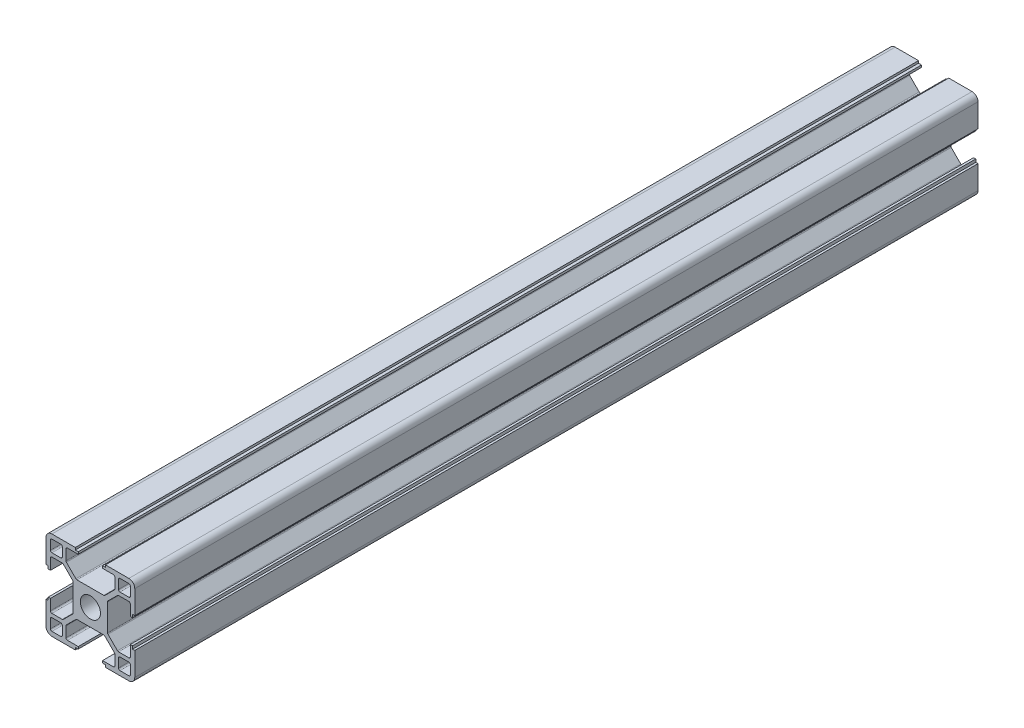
SolidWorks part; units mm, degrees
other "Body1"
ref_plane "Płaszczyzna przednia" through (0, 0, 0) normal (0, 0, 1) x (1, 0, 0)
ref_plane "Płaszczyzna górna" through (0, 0, 0) normal (0, 1, 0) x (1, 0, 0)
ref_plane "Płaszczyzna prawa" through (0, 0, 0) normal (1, 0, 0) x (0, 0, -1)
imported_body "Import1"
sketch "Szkic1" plane through (0, 0, 170) normal (0, 0, 1) x (1, 0, 0)
  line L4 (24.9798, 1.4394) -> (27.9798, 1.4394)
  line L5 (24.4798, 4.9394) -> (24.4798, 1.9394)
  line L6 (27.9798, 5.4394) -> (24.9798, 5.4394)
  line L7 (28.4798, 1.9394) -> (28.4798, 4.9394)
  line L8 (24.9798, 1.4394) -> (27.9798, 1.4394)
  line L9 (24.4798, 4.9394) -> (24.4798, 1.9394)
  line L10 (27.9798, 5.4394) -> (24.9798, 5.4394)
  line L11 (28.4798, 1.9394) -> (28.4798, 4.9394)
  line L12 (1.4798, 4.9394) -> (1.4798, 1.9394)
  line L13 (4.9798, 5.4394) -> (1.9798, 5.4394)
  line L14 (5.4798, 1.9394) -> (5.4798, 4.9394)
  line L15 (1.9798, 1.4394) -> (4.9798, 1.4394)
  line L16 (1.4798, 4.9394) -> (1.4798, 1.9394)
  line L17 (4.9798, 5.4394) -> (1.9798, 5.4394)
  line L18 (5.4798, 1.9394) -> (5.4798, 4.9394)
  line L19 (1.9798, 1.4394) -> (4.9798, 1.4394)
  line L20 (4.9798, 28.4394) -> (1.9798, 28.4394)
  line L21 (5.4798, 24.9394) -> (5.4798, 27.9394)
  line L22 (1.9798, 24.4394) -> (4.9798, 24.4394)
  line L23 (1.4798, 27.9394) -> (1.4798, 24.9394)
  line L24 (4.9798, 28.4394) -> (1.9798, 28.4394)
  line L25 (5.4798, 24.9394) -> (5.4798, 27.9394)
  line L26 (1.9798, 24.4394) -> (4.9798, 24.4394)
  line L27 (1.4798, 27.9394) -> (1.4798, 24.9394)
  line L28 (28.4798, 24.9394) -> (28.4798, 27.9394)
  line L29 (24.9798, 24.4394) -> (27.9798, 24.4394)
  line L30 (24.4798, 27.9394) -> (24.4798, 24.9394)
  line L31 (27.9798, 28.4394) -> (24.9798, 28.4394)
  line L32 (28.4798, 24.9394) -> (28.4798, 27.9394)
  line L33 (24.9798, 24.4394) -> (27.9798, 24.4394)
  line L34 (24.4798, 27.9394) -> (24.4798, 24.9394)
  line L35 (27.9798, 28.4394) -> (24.9798, 28.4394)
  line L60 (-0.0202, 9.8394) -> (-0.0202, 1.9394)
  line L61 (1.9798, -0.0606) -> (9.8798, -0.0606)
  line L62 (9.8798, -0.0606) -> (9.8798, 0.6894)
  line L63 (9.8798, 0.6894) -> (10.8798, 0.6894)
  line L64 (10.8798, 0.6894) -> (10.8798, 1.4394)
  line L65 (10.8798, 1.4394) -> (7.2298, 1.4394)
  line L66 (6.7298, 1.9394) -> (6.7298, 5.4216)
  line L67 (6.8762, 5.7752) -> (10.094, 8.9929)
  line L68 (10.4475, 9.1394) -> (19.512, 9.1394)
  line L69 (19.8656, 8.9929) -> (23.0833, 5.7752)
  line L70 (23.2298, 5.4216) -> (23.2298, 1.9394)
  line L71 (22.7298, 1.4394) -> (19.0798, 1.4394)
  line L72 (19.0798, 1.4394) -> (19.0798, 0.6894)
  line L73 (19.0798, 0.6894) -> (20.0798, 0.6894)
  line L74 (20.0798, 0.6894) -> (20.0798, -0.0606)
  line L75 (20.0798, -0.0606) -> (27.9798, -0.0606)
  line L76 (29.9798, 1.9394) -> (29.9798, 9.8394)
  line L77 (29.9798, 9.8394) -> (29.2298, 9.8394)
  line L78 (29.2298, 9.8394) -> (29.2298, 10.8394)
  line L79 (29.2298, 10.8394) -> (28.4798, 10.8394)
  line L80 (28.4798, 10.8394) -> (28.4798, 7.1894)
  line L81 (27.9798, 6.6894) -> (24.4975, 6.6894)
  line L82 (24.144, 6.8358) -> (20.9262, 10.0536)
  line L83 (20.7798, 10.4071) -> (20.7798, 19.4716)
  line L84 (20.9262, 19.8252) -> (24.144, 23.0429)
  line L85 (24.4975, 23.1894) -> (27.9798, 23.1894)
  line L86 (28.4798, 22.6894) -> (28.4798, 19.0394)
  line L87 (28.4798, 19.0394) -> (29.2298, 19.0394)
  line L88 (29.2298, 19.0394) -> (29.2298, 20.0394)
  line L89 (29.2298, 20.0394) -> (29.9798, 20.0394)
  line L90 (29.9798, 20.0394) -> (29.9798, 27.9394)
  line L91 (27.9798, 29.9394) -> (20.0798, 29.9394)
  line L92 (20.0798, 29.9394) -> (20.0798, 29.1894)
  line L93 (20.0798, 29.1894) -> (19.0798, 29.1894)
  line L94 (19.0798, 29.1894) -> (19.0798, 28.4394)
  line L95 (19.0798, 28.4394) -> (22.7298, 28.4394)
  line L96 (23.2298, 27.9394) -> (23.2298, 24.4571)
  line L97 (23.0833, 24.1036) -> (19.8656, 20.8858)
  line L98 (19.512, 20.7394) -> (10.4475, 20.7394)
  line L99 (10.094, 20.8858) -> (6.8762, 24.1036)
  line L100 (6.7298, 24.4571) -> (6.7298, 27.9394)
  line L101 (7.2298, 28.4394) -> (10.8798, 28.4394)
  line L102 (10.8798, 28.4394) -> (10.8798, 29.1894)
  line L103 (10.8798, 29.1894) -> (9.8798, 29.1894)
  line L104 (9.8798, 29.1894) -> (9.8798, 29.9394)
  line L105 (9.8798, 29.9394) -> (1.9798, 29.9394)
  line L106 (-0.0202, 27.9394) -> (-0.0202, 20.0394)
  line L107 (-0.0202, 20.0394) -> (0.7298, 20.0394)
  line L108 (0.7298, 20.0394) -> (0.7298, 19.0394)
  line L109 (0.7298, 19.0394) -> (1.4798, 19.0394)
  line L110 (1.4798, 19.0394) -> (1.4798, 22.6894)
  line L111 (1.9798, 23.1894) -> (5.462, 23.1894)
  line L112 (5.8156, 23.0429) -> (9.0333, 19.8252)
  line L113 (9.1798, 19.4716) -> (9.1798, 10.4071)
  line L114 (9.0333, 10.0536) -> (5.8156, 6.8358)
  line L115 (5.462, 6.6894) -> (1.9798, 6.6894)
  line L116 (1.4798, 7.1894) -> (1.4798, 10.8394)
  line L117 (1.4798, 10.8394) -> (0.7298, 10.8394)
  line L118 (0.7298, 10.8394) -> (0.7298, 9.8394)
  line L119 (0.7298, 9.8394) -> (-0.0202, 9.8394)
  line L120 (-0.0202, 9.8394) -> (-0.0202, 1.9394)
  line L121 (1.9798, -0.0606) -> (9.8798, -0.0606)
  line L122 (9.8798, -0.0606) -> (9.8798, 0.6894)
  line L123 (9.8798, 0.6894) -> (10.8798, 0.6894)
  line L124 (10.8798, 0.6894) -> (10.8798, 1.4394)
  line L125 (10.8798, 1.4394) -> (7.2298, 1.4394)
  line L126 (6.7298, 1.9394) -> (6.7298, 5.4216)
  line L127 (6.8762, 5.7752) -> (10.094, 8.9929)
  line L128 (10.4475, 9.1394) -> (19.512, 9.1394)
  line L129 (19.8656, 8.9929) -> (23.0833, 5.7752)
  line L130 (23.2298, 5.4216) -> (23.2298, 1.9394)
  line L131 (22.7298, 1.4394) -> (19.0798, 1.4394)
  line L132 (19.0798, 1.4394) -> (19.0798, 0.6894)
  line L133 (19.0798, 0.6894) -> (20.0798, 0.6894)
  line L134 (20.0798, 0.6894) -> (20.0798, -0.0606)
  line L135 (20.0798, -0.0606) -> (27.9798, -0.0606)
  line L136 (29.9798, 1.9394) -> (29.9798, 9.8394)
  line L137 (29.9798, 9.8394) -> (29.2298, 9.8394)
  line L138 (29.2298, 9.8394) -> (29.2298, 10.8394)
  line L139 (29.2298, 10.8394) -> (28.4798, 10.8394)
  line L140 (28.4798, 10.8394) -> (28.4798, 7.1894)
  line L141 (27.9798, 6.6894) -> (24.4975, 6.6894)
  line L142 (24.144, 6.8358) -> (20.9262, 10.0536)
  line L143 (20.7798, 10.4071) -> (20.7798, 19.4716)
  line L144 (20.9262, 19.8252) -> (24.144, 23.0429)
  line L145 (24.4975, 23.1894) -> (27.9798, 23.1894)
  line L146 (28.4798, 22.6894) -> (28.4798, 19.0394)
  line L147 (28.4798, 19.0394) -> (29.2298, 19.0394)
  line L148 (29.2298, 19.0394) -> (29.2298, 20.0394)
  line L149 (29.2298, 20.0394) -> (29.9798, 20.0394)
  line L150 (29.9798, 20.0394) -> (29.9798, 27.9394)
  line L151 (27.9798, 29.9394) -> (20.0798, 29.9394)
  line L152 (20.0798, 29.9394) -> (20.0798, 29.1894)
  line L153 (20.0798, 29.1894) -> (19.0798, 29.1894)
  line L154 (19.0798, 29.1894) -> (19.0798, 28.4394)
  line L155 (19.0798, 28.4394) -> (22.7298, 28.4394)
  line L156 (23.2298, 27.9394) -> (23.2298, 24.4571)
  line L157 (23.0833, 24.1036) -> (19.8656, 20.8858)
  line L158 (19.512, 20.7394) -> (10.4475, 20.7394)
  line L159 (10.094, 20.8858) -> (6.8762, 24.1036)
  line L160 (6.7298, 24.4571) -> (6.7298, 27.9394)
  line L161 (7.2298, 28.4394) -> (10.8798, 28.4394)
  line L162 (10.8798, 28.4394) -> (10.8798, 29.1894)
  line L163 (10.8798, 29.1894) -> (9.8798, 29.1894)
  line L164 (9.8798, 29.1894) -> (9.8798, 29.9394)
  line L165 (9.8798, 29.9394) -> (1.9798, 29.9394)
  line L166 (-0.0202, 27.9394) -> (-0.0202, 20.0394)
  line L167 (-0.0202, 20.0394) -> (0.7298, 20.0394)
  line L168 (0.7298, 20.0394) -> (0.7298, 19.0394)
  line L169 (0.7298, 19.0394) -> (1.4798, 19.0394)
  line L170 (1.4798, 19.0394) -> (1.4798, 22.6894)
  line L171 (1.9798, 23.1894) -> (5.462, 23.1894)
  line L172 (5.8156, 23.0429) -> (9.0333, 19.8252)
  line L173 (9.1798, 19.4716) -> (9.1798, 10.4071)
  line L174 (9.0333, 10.0536) -> (5.8156, 6.8358)
  line L175 (5.462, 6.6894) -> (1.9798, 6.6894)
  line L176 (1.4798, 7.1894) -> (1.4798, 10.8394)
  line L177 (1.4798, 10.8394) -> (0.7298, 10.8394)
  line L178 (0.7298, 10.8394) -> (0.7298, 9.8394)
  line L179 (0.7298, 9.8394) -> (-0.0202, 9.8394)
  circle A1 centre (14.9798, 14.9394) radius 3.4
  circle A2 centre (14.9798, 14.9394) radius 3.4
  arc A4 (27.9798, 1.4394) -> (28.4798, 1.9394) centre (27.9798, 1.9394) ccw
  arc A5 (24.4798, 1.9394) -> (24.9798, 1.4394) centre (24.9798, 1.9394) ccw
  arc A6 (24.9798, 5.4394) -> (24.4798, 4.9394) centre (24.9798, 4.9394) ccw
  arc A7 (28.4798, 4.9394) -> (27.9798, 5.4394) centre (27.9798, 4.9394) ccw
  arc A8 (27.9798, 1.4394) -> (28.4798, 1.9394) centre (27.9798, 1.9394) ccw
  arc A9 (24.4798, 1.9394) -> (24.9798, 1.4394) centre (24.9798, 1.9394) ccw
  arc A10 (24.9798, 5.4394) -> (24.4798, 4.9394) centre (24.9798, 4.9394) ccw
  arc A11 (28.4798, 4.9394) -> (27.9798, 5.4394) centre (27.9798, 4.9394) ccw
  arc A12 (1.4798, 1.9394) -> (1.9798, 1.4394) centre (1.9798, 1.9394) ccw
  arc A13 (1.9798, 5.4394) -> (1.4798, 4.9394) centre (1.9798, 4.9394) ccw
  arc A14 (5.4798, 4.9394) -> (4.9798, 5.4394) centre (4.9798, 4.9394) ccw
  arc A15 (4.9798, 1.4394) -> (5.4798, 1.9394) centre (4.9798, 1.9394) ccw
  arc A16 (1.4798, 1.9394) -> (1.9798, 1.4394) centre (1.9798, 1.9394) ccw
  arc A17 (1.9798, 5.4394) -> (1.4798, 4.9394) centre (1.9798, 4.9394) ccw
  arc A18 (5.4798, 4.9394) -> (4.9798, 5.4394) centre (4.9798, 4.9394) ccw
  arc A19 (4.9798, 1.4394) -> (5.4798, 1.9394) centre (4.9798, 1.9394) ccw
  arc A22 (1.9798, 28.4394) -> (1.4798, 27.9394) centre (1.9798, 27.9394) ccw
  arc A23 (5.4798, 27.9394) -> (4.9798, 28.4394) centre (4.9798, 27.9394) ccw
  arc A24 (4.9798, 24.4394) -> (5.4798, 24.9394) centre (4.9798, 24.9394) ccw
  arc A25 (1.4798, 24.9394) -> (1.9798, 24.4394) centre (1.9798, 24.9394) ccw
  arc A26 (1.9798, 28.4394) -> (1.4798, 27.9394) centre (1.9798, 27.9394) ccw
  arc A27 (5.4798, 27.9394) -> (4.9798, 28.4394) centre (4.9798, 27.9394) ccw
  arc A28 (-0.0202, 1.9394) -> (1.9798, -0.0606) centre (1.9798, 1.9394) ccw
  arc A29 (6.7298, 1.9394) -> (7.2298, 1.4394) centre (7.2298, 1.9394) ccw
  arc A30 (6.8762, 5.7752) -> (6.7298, 5.4216) centre (7.2298, 5.4216) ccw
  arc A31 (10.4475, 9.1394) -> (10.094, 8.9929) centre (10.4475, 8.6394) ccw
  arc A32 (19.8656, 8.9929) -> (19.512, 9.1394) centre (19.512, 8.6394) ccw
  arc A33 (23.2298, 5.4216) -> (23.0833, 5.7752) centre (22.7298, 5.4216) ccw
  arc A34 (22.7298, 1.4394) -> (23.2298, 1.9394) centre (22.7298, 1.9394) ccw
  arc A35 (27.9798, -0.0606) -> (29.9798, 1.9394) centre (27.9798, 1.9394) ccw
  arc A36 (27.9798, 6.6894) -> (28.4798, 7.1894) centre (27.9798, 7.1894) ccw
  arc A37 (24.144, 6.8358) -> (24.4975, 6.6894) centre (24.4975, 7.1894) ccw
  arc A38 (20.7798, 10.4071) -> (20.9262, 10.0536) centre (21.2798, 10.4071) ccw
  arc A39 (20.9262, 19.8252) -> (20.7798, 19.4716) centre (21.2798, 19.4716) ccw
  arc A40 (24.4975, 23.1894) -> (24.144, 23.0429) centre (24.4975, 22.6894) ccw
  arc A41 (28.4798, 22.6894) -> (27.9798, 23.1894) centre (27.9798, 22.6894) ccw
  arc A42 (29.9798, 27.9394) -> (27.9798, 29.9394) centre (27.9798, 27.9394) ccw
  arc A43 (23.2298, 27.9394) -> (22.7298, 28.4394) centre (22.7298, 27.9394) ccw
  arc A44 (23.0833, 24.1036) -> (23.2298, 24.4571) centre (22.7298, 24.4571) ccw
  arc A45 (19.512, 20.7394) -> (19.8656, 20.8858) centre (19.512, 21.2394) ccw
  arc A46 (10.094, 20.8858) -> (10.4475, 20.7394) centre (10.4475, 21.2394) ccw
  arc A47 (6.7298, 24.4571) -> (6.8762, 24.1036) centre (7.2298, 24.4571) ccw
  arc A48 (7.2298, 28.4394) -> (6.7298, 27.9394) centre (7.2298, 27.9394) ccw
  arc A49 (1.9798, 29.9394) -> (-0.0202, 27.9394) centre (1.9798, 27.9394) ccw
  arc A50 (1.9798, 23.1894) -> (1.4798, 22.6894) centre (1.9798, 22.6894) ccw
  arc A51 (5.8156, 23.0429) -> (5.462, 23.1894) centre (5.462, 22.6894) ccw
  arc A52 (9.1798, 19.4716) -> (9.0333, 19.8252) centre (8.6798, 19.4716) ccw
  arc A53 (9.0333, 10.0536) -> (9.1798, 10.4071) centre (8.6798, 10.4071) ccw
  arc A54 (5.462, 6.6894) -> (5.8156, 6.8358) centre (5.462, 7.1894) ccw
  arc A55 (1.4798, 7.1894) -> (1.9798, 6.6894) centre (1.9798, 7.1894) ccw
  arc A56 (-0.0202, 1.9394) -> (1.9798, -0.0606) centre (1.9798, 1.9394) ccw
  arc A57 (6.7298, 1.9394) -> (7.2298, 1.4394) centre (7.2298, 1.9394) ccw
  arc A58 (6.8762, 5.7752) -> (6.7298, 5.4216) centre (7.2298, 5.4216) ccw
  arc A59 (10.4475, 9.1394) -> (10.094, 8.9929) centre (10.4475, 8.6394) ccw
  arc A60 (19.8656, 8.9929) -> (19.512, 9.1394) centre (19.512, 8.6394) ccw
  arc A61 (23.2298, 5.4216) -> (23.0833, 5.7752) centre (22.7298, 5.4216) ccw
  arc A62 (22.7298, 1.4394) -> (23.2298, 1.9394) centre (22.7298, 1.9394) ccw
  arc A63 (27.9798, -0.0606) -> (29.9798, 1.9394) centre (27.9798, 1.9394) ccw
  arc A64 (27.9798, 6.6894) -> (28.4798, 7.1894) centre (27.9798, 7.1894) ccw
  arc A65 (24.144, 6.8358) -> (24.4975, 6.6894) centre (24.4975, 7.1894) ccw
  arc A66 (20.7798, 10.4071) -> (20.9262, 10.0536) centre (21.2798, 10.4071) ccw
  arc A67 (20.9262, 19.8252) -> (20.7798, 19.4716) centre (21.2798, 19.4716) ccw
  arc A68 (24.4975, 23.1894) -> (24.144, 23.0429) centre (24.4975, 22.6894) ccw
  arc A69 (28.4798, 22.6894) -> (27.9798, 23.1894) centre (27.9798, 22.6894) ccw
  arc A70 (29.9798, 27.9394) -> (27.9798, 29.9394) centre (27.9798, 27.9394) ccw
  arc A71 (23.2298, 27.9394) -> (22.7298, 28.4394) centre (22.7298, 27.9394) ccw
  arc A72 (23.0833, 24.1036) -> (23.2298, 24.4571) centre (22.7298, 24.4571) ccw
  arc A73 (19.512, 20.7394) -> (19.8656, 20.8858) centre (19.512, 21.2394) ccw
  arc A74 (10.094, 20.8858) -> (10.4475, 20.7394) centre (10.4475, 21.2394) ccw
  arc A75 (6.7298, 24.4571) -> (6.8762, 24.1036) centre (7.2298, 24.4571) ccw
  arc A76 (7.2298, 28.4394) -> (6.7298, 27.9394) centre (7.2298, 27.9394) ccw
  arc A77 (1.9798, 29.9394) -> (-0.0202, 27.9394) centre (1.9798, 27.9394) ccw
  arc A78 (1.9798, 23.1894) -> (1.4798, 22.6894) centre (1.9798, 22.6894) ccw
  arc A79 (5.8156, 23.0429) -> (5.462, 23.1894) centre (5.462, 22.6894) ccw
  arc A80 (9.1798, 19.4716) -> (9.0333, 19.8252) centre (8.6798, 19.4716) ccw
  arc A81 (9.0333, 10.0536) -> (9.1798, 10.4071) centre (8.6798, 10.4071) ccw
  arc A82 (5.462, 6.6894) -> (5.8156, 6.8358) centre (5.462, 7.1894) ccw
  arc A83 (1.4798, 7.1894) -> (1.9798, 6.6894) centre (1.9798, 7.1894) ccw
  arc A84 (4.9798, 24.4394) -> (5.4798, 24.9394) centre (4.9798, 24.9394) ccw
  arc A85 (1.4798, 24.9394) -> (1.9798, 24.4394) centre (1.9798, 24.9394) ccw
  arc A86 (28.4798, 27.9394) -> (27.9798, 28.4394) centre (27.9798, 27.9394) ccw
  arc A87 (27.9798, 24.4394) -> (28.4798, 24.9394) centre (27.9798, 24.9394) ccw
  arc A88 (24.4798, 24.9394) -> (24.9798, 24.4394) centre (24.9798, 24.9394) ccw
  arc A89 (24.9798, 28.4394) -> (24.4798, 27.9394) centre (24.9798, 27.9394) ccw
  arc A90 (28.4798, 27.9394) -> (27.9798, 28.4394) centre (27.9798, 27.9394) ccw
  arc A91 (27.9798, 24.4394) -> (28.4798, 24.9394) centre (27.9798, 24.9394) ccw
  arc A92 (24.4798, 24.9394) -> (24.9798, 24.4394) centre (24.9798, 24.9394) ccw
  arc A93 (24.9798, 28.4394) -> (24.4798, 27.9394) centre (24.9798, 27.9394) ccw
  dimension "D1" = 0
  dimension "D2" = 0
  dimension "D3" = 0
  dimension "D4" = 0
  dimension "D5" = 0
  dimension "D6" = 0
extrude "Wytnij-wyciągnięcie2" cut sketch "Szkic1" against normal blind 55
